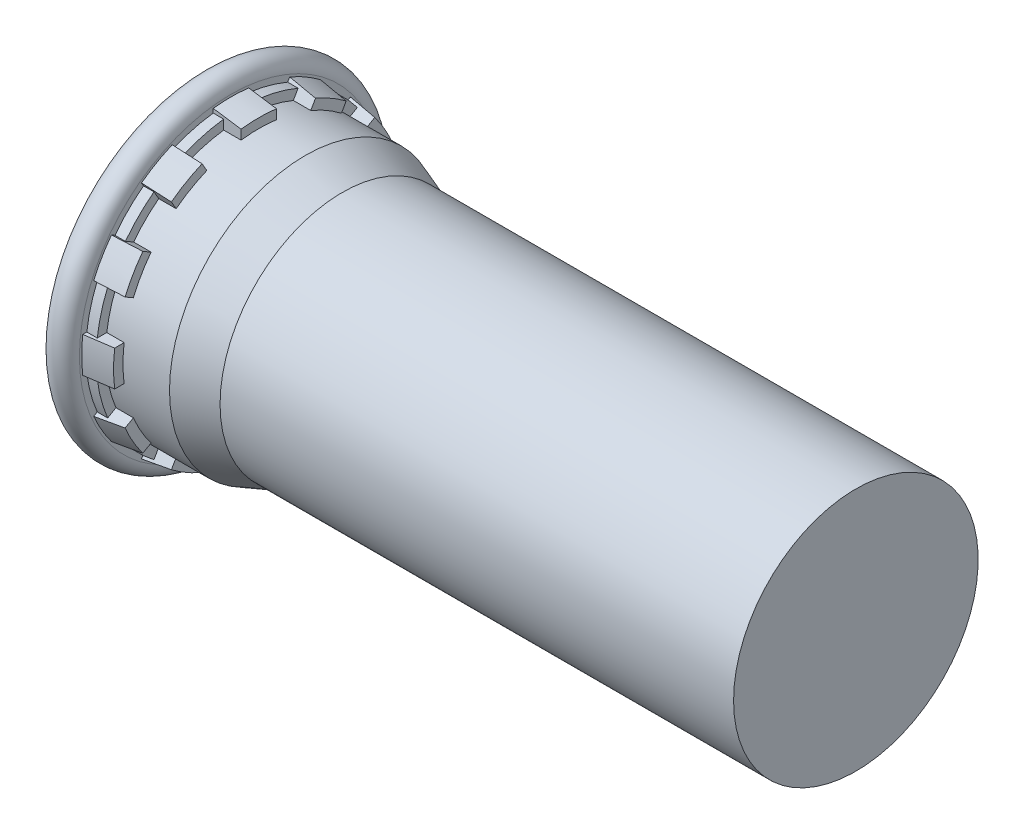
SolidWorks part; units mm, degrees
ref_plane "Plane1" through (0, 0, 0) normal (0, 0, 1) x (1, 0, 0)
ref_plane "Plane2" through (0, 0, 0) normal (0, 1, 0) x (1, 0, 0)
ref_plane "Plane3" through (0, 0, 0) normal (1, 0, 0) x (0, 0, -1)
sketch "BodySke" plane through (0, 0, 0) normal (0, 0, 1) x (1, 0, 0)
  line L0 (0, 0) -> (0, 4.4171)
  line L1 (0.8128, 4.4221) -> (0.8128, 4.3561)
  line L2 (0.8128, 4.3561) -> (1.6256, 4.238)
  line L3 (4.064, 3.5687) -> (19.05, 3.5687)
  line L4 (19.05, 3.5687) -> (19.05, 0)
  line L5 (19.05, 0) -> (0, 0)
  line L6 (0, 0) -> (50.554, 0) construction
  line L7 (1.6256, 4.238) -> (1.6256, 3.9624)
  line L8 (2.9823, 3.9624) -> (1.6256, 3.9624)
  line L9 (-9.525, 4.826) -> (9.525, 4.826) construction
  line L11 (4.064, 3.5687) -> (2.9823, 3.9624)
  line L13 (9.525, -4.826) -> (-9.525, -4.826) construction
  line L14 (0.0051, 4.4221) -> (0.0051, 4.4171)
  line L15 (0, 4.4171) -> (0.0051, 4.4171)
  arc A0 (0.0051, 4.4221) -> (0.8128, 4.4221) centre (0.4089, 4.4221) cw
  dimension "D2" = 0.0051
  dimension "D1" = 0.0051
  dimension "Diameter" = 7.1374
  dimension "D3" = 20
  dimension "Length" = 19.05
  dimension "H_dia" = 9.652
  dimension "Shoulder_lower_dia" = 8.7122
  dimension "Shoulder_upper_dia" = 8.476
  dimension "Shoulder_ht" = 1.6256
  dimension "T_dim" = 0.8128
  dimension "Neck_len" = 4.064
  dimension "Neck_dia" = 7.9248
revolve "BaseBody" add sketch "BodySke" angle 360 about L6
sketch "RibCut1Ske" plane through (1.6256, 0, 0) normal (1, 0, 0) x (0, 0, -1)
  line L0 (0.5172, 3.9285) -> (0.5172, 4.7982)
  line L1 (1.5163, 3.6608) -> (1.9512, 4.414)
  line L2 (0, 0) -> (0, 4.9784) construction
  line L3 (0, 0) -> (0.5172, 3.9285) construction
  line L4 (0, 0) -> (1.5163, 3.6608) construction
  arc A1 (1.5163, 3.6608) -> (0.5172, 3.9285) centre (0, 0) ccw
  arc A2 (1.9512, 4.414) -> (0.5172, 4.7982) centre (0, 0) ccw
  dimension "Inner_dia" = 7.9248
  dimension "Outer_dia" = 9.652
  dimension "Rib_root_half_angle" = 7.5
  dimension "Rib_root_gap_angle" = 15
  dimension "Angle" = 30
extrude "RibCut1" cut sketch "RibCut1Ske" against normal blind 0.508
sketch "RibCut2Ske" plane through (1.6256, 0, 0) normal (1, 0, 0) x (0, 0, -1)
  line L0 (0.5172, 4.2063) -> (0.5172, 4.7982)
  line L1 (1.6553, 3.9014) -> (1.9512, 4.414)
  line L2 (0.5172, 3.9285) -> (0.5172, 5.7403) construction
  line L3 (0, 0) -> (0, 5.0239) construction
  line L4 (0, 0) -> (0.5172, 3.9285) construction
  line L5 (0, 0) -> (1.5163, 3.6608) construction
  line L6 (1.5163, 3.6608) -> (2.4258, 5.2359) construction
  arc A1 (1.6553, 3.9014) -> (0.5172, 4.2063) centre (0, 0) ccw
  arc A2 (1.9512, 4.414) -> (0.5172, 4.7982) centre (0, 0) ccw
  circle A4 centre (0, 0) radius 3.9624 construction
  dimension "Inner_dia" = 8.476
  dimension "Outer_dia" = 9.652
  dimension "Rib_root_dia" = 7.9248
  dimension "Rib_root_half_angle" = 7.5
  dimension "Rib_root_gap_angle" = 15
  dimension "Angle" = 30
extrude "RibCut2" cut sketch "RibCut2Ske" against normal blind 0.8128
pattern_circular "RibCutsPat" count 12 every 30 about axis through (0, 0, 0) along (1, 0, 0) of "RibCut2", "RibCut1"
equation "' \"Diameter@BodySke\" = 0.281"
equation "' \"Length@BodySke\" = 0.75"
equation "' \"Neck_dia@BodySke\" = 0.312"
equation "' \"H_dia@BodySke\" = 0.38"
equation "' \"Neck_len@BodySke\" = 0.16"
equation "\"T_dim@BodySke\" = \"Neck_len@BodySke\" * 0.2"
equation "\"Shoulder_ht@BodySke\" = \"Neck_len@BodySke\" * 0.4"
equation "\"Shoulder_lower_dia@BodySke\" = \"H_dia@BodySke\" - \"Neck_len@BodySke\" * 0.2 - .005"
equation "\"Shoulder_upper_dia@BodySke\" = ( \"Shoulder_lower_dia@BodySke\" + \"Diameter@BodySke\" ) /2"
equation "\"Shoulder_upper_dia@BodySke\" = \"Diameter@BodySke\" +  ( \"Shoulder_lower_dia@BodySke\" - \"Diameter@BodySke\" ) * 0.85"
equation "\"Num_ribs@RibCutsPat\" = 12"
equation "\"Angle@RibCutsPat\" = 360 / \"Num_ribs@RibCutsPat\""
equation "\"Angle@RibCut1Ske\" =\"Angle@RibCutsPat\""
equation "\"Rib_root_half_angle@RibCut1Ske\" = \"Angle@RibCut1Ske\" / 4"
equation "\"Rib_root_gap_angle@RibCut1Ske\" = \"Angle@RibCut1Ske\" - (2 * \"Rib_root_half_angle@RibCut1Ske\" )"
equation "\"Inner_dia@RibCut1Ske\" = \"Neck_dia@BodySke\""
equation "\"Outer_dia@RibCut1Ske\" = \"H_dia@BodySke\""
equation "\"Depth@RibCut1\" =  \"Neck_len@BodySke\" * 0.125"
equation "\"Angle@RibCut2Ske\" =\"Angle@RibCutsPat\""
equation "\"Rib_root_half_angle@RibCut2Ske\" = \"Angle@RibCut1Ske\" / 4"
equation "\"Rib_root_gap_angle@RibCut2Ske\" = \"Angle@RibCut1Ske\" - (2 * \"Rib_root_half_angle@RibCut1Ske\" )"
equation "\"Rib_root_dia@RibCut2Ske\" = \"Neck_dia@BodySke\""
equation "\"Inner_dia@RibCut2Ske\" = \"Shoulder_upper_dia@BodySke\""
equation "\"Outer_dia@RibCut2Ske\" = \"H_dia@BodySke\""
equation "\"Depth@RibCut2\" =  \"Neck_len@BodySke\" * 0.2"
